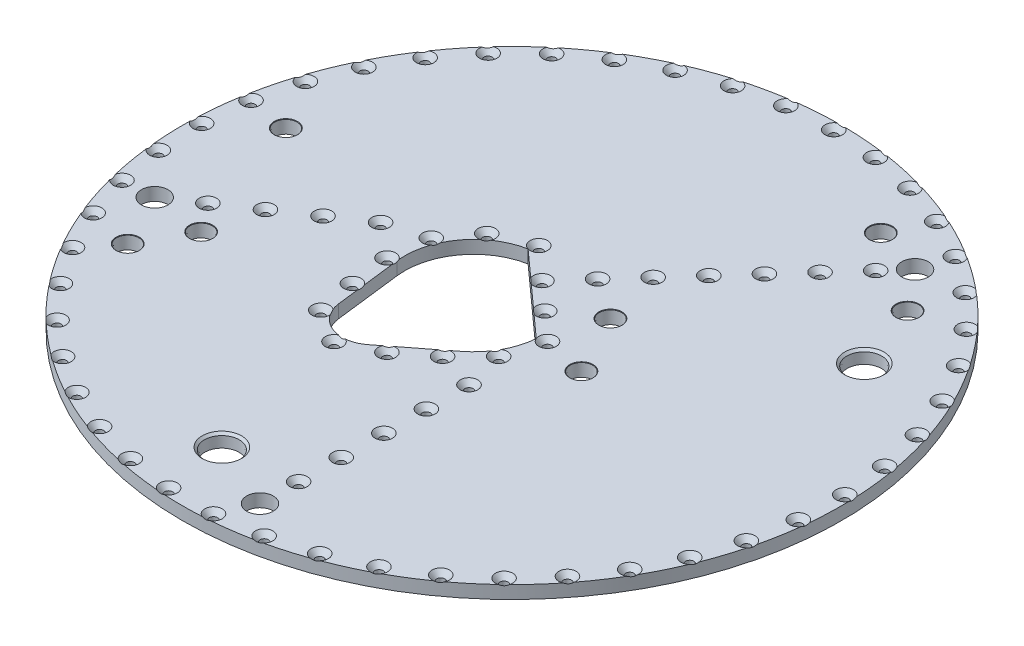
SolidWorks part; units mm, degrees
ref_plane "Front Plane" through (0, 0, 0) normal (0, 0, 1) x (1, 0, 0)
ref_plane "Top Plane" through (0, 0, 0) normal (0, 1, 0) x (1, 0, 0)
ref_plane "Right Plane" through (0, 0, 0) normal (1, 0, 0) x (0, 0, -1)
sketch "Sketch1" plane through (0, 0, 0) normal (0, 1, 0) x (1, 0, 0)
  line L0 (-28.7423, -59.6007) -> (3.5651, -34.4529)
  line L1 (-64.2578, -6.2017) -> (-59.3566, -46.8485)
  line L2 (19.685, -4.826) -> (-30.4091, 40.2789)
  line L3 (0, 0) -> (-76.2073, 0) construction
  line L4 (-172.2388, -46.7164) -> (22.5792, -177.0184) construction
  line L5 (-74.824, -111.8713) -> (98.9891, 148.0013) construction
  circle A0 centre (0, 0) radius 201.93
  arc A1 (3.5651, -34.4529) -> (19.685, -4.826) centre (-22.3579, -1.1494) ccw
  arc A2 (-59.3566, -46.8485) -> (-28.7423, -59.6007) centre (-40.4436, -44.568) ccw
  arc A3 (-30.4091, 40.2789) -> (-64.2578, -6.2017) centre (-22.3579, -1.1494) ccw
  circle A4 centre (98.9891, 148.0013) radius 8.128
  circle A5 centre (-172.2388, -46.7164) radius 8.128
  circle A6 centre (22.5792, -177.0184) radius 8.128
  point P12 (22.5792, -177.0184)
  point P13 (-172.2388, -46.7164)
  dimension "D1" = 403.86
  dimension "D2" = 42.2034
  dimension "D3" = 19.05
  dimension "D4" = 42.2034
  dimension "D20" = 16.256
  dimension "D21" = 16.256
  dimension "D22" = 16.256
  dimension "D15" = 148.0013
  dimension "D5" = 67.4082
  dimension "D6" = 40.6468
  dimension "D7" = 40.9412
  dimension "D8" = 42
  dimension "D9" = 41.124
  dimension "D10" = 79.897
  dimension "D11" = 46.4806
  dimension "D12" = 12.7522
  dimension "D13" = 4.826
  dimension "D14" = 19.685
  dimension "D16" = 312.6416
  dimension "D17" = 234.3772
  dimension "D18" = 117.1956
  dimension "D19" = 178.054
extrude "Extrude1" add sketch "Sketch1" along normal blind 7.9375
hole_wizard "CSK for #10 Flat Head Machine Screw1" positions "3DSketch2" profile "Sketch6" countersink size "#10" standard "Ansi Inch"
sketch3d "3DSketch2"
  point P0 (0, 7.9375, -197.1675)
sketch "Sketch6" plane through (0, 7.9375, -197.1675) normal (1, 0, 0) x (0, 0, 1)
  line L0 (0, 0) -> (0, 7.9375)
  line L1 (0, 7.9375) -> (2.4892, 7.9375)
  line L2 (2.4892, 7.9375) -> (2.4892, 3.2692)
  line L3 (2.4892, 3.2692) -> (5.3311, 0)
  line L5 (5.3311, 0) -> (0, 0)
  line L6 (-2.4892, 3.2692) -> (-5.3311, 0) construction
  line L11 (0, -6.35) -> (0, 107.95) construction
  dimension "Thru Hole Dia." = 4.9784
  dimension "Thru Hole Depth" = 7.9375
  dimension "Near C'Sink Dia." = 10.6622
  dimension "Near C'Sink Angle" = 82
pattern_circular "CirPattern1" count 45 over 360 about axis through (0, 0, 0) along (0, 1, 0) of "CSK for #10 Flat Head Machine Screw1"
sketch "Sketch7" plane through (0, 7.9375, 0) normal (0, 1, 0) x (1, 0, 0)
  line L0 (22.5792, -177.0184) -> (23.8965, -9.293) construction
  line L1 (0, 0) -> (0, -222.0536) construction
  line L3 (98.9891, 148.0013) -> (-9.3265, 27.7046) construction
  line L4 (-172.2388, -46.7164) -> (-54.914, 32.7012) construction
  line L6 (-25.817, -63.3589) -> (6.4905, -38.2111)
  line L7 (-68.9861, -6.7719) -> (-64.0849, -47.4187)
  line L8 (24.5781, -2.8232) -> (-28.9287, 45.3546)
  line L9 (-25.817, -63.3589) -> (6.4905, -38.2111) construction
  line L10 (-68.9861, -6.7719) -> (-64.0849, -47.4187) construction
  line L11 (24.5781, -2.8232) -> (-28.9287, 45.3546) construction
  arc A2 (-31.3176, 44.9539) -> (-68.9861, -6.7719) centre (-22.3579, -1.1494) ccw
  arc A3 (-31.3176, 44.9539) -> (-68.9861, -6.7719) centre (-22.3579, -1.1494) ccw construction
  arc A6 (6.4905, -38.2111) -> (24.5781, -2.8232) centre (-22.3579, -1.1494) ccw
  arc A7 (-64.0849, -47.4187) -> (-25.817, -63.3589) centre (-40.4436, -44.568) ccw
  arc A8 (-28.9287, 45.3546) -> (-68.9861, -6.7719) centre (-22.3579, -1.1494) ccw
  arc A9 (6.4905, -38.2111) -> (24.5781, -2.8232) centre (-22.3579, -1.1494) ccw construction
  arc A10 (-64.0849, -47.4187) -> (-25.817, -63.3589) centre (-40.4436, -44.568) ccw construction
  dimension "D3" = 0.45
  dimension "D1" = 4.7625
  dimension "D2" = 4.7625
hole_wizard "CSK for #10 Flat Head Machine Screw2" positions "3DSketch3" profile "Sketch8" countersink size "#10" standard "Ansi Inch"
sketch3d "3DSketch3"
  point P0 (-9.3265, 7.9375, -27.7046)
sketch "Sketch8" plane through (-9.3265, 7.9375, -27.7046) normal (1, 0, 0) x (0, 0, 1)
  line L0 (0, 0) -> (0, 7.9375)
  line L1 (0, 7.9375) -> (2.4892, 7.9375)
  line L2 (2.4892, 7.9375) -> (2.4892, 3.2692)
  line L3 (2.4892, 3.2692) -> (5.3311, 0)
  line L5 (5.3311, 0) -> (0, 0)
  line L6 (-2.4892, 3.2692) -> (-5.3311, 0) construction
  line L11 (0, -6.35) -> (0, 107.95) construction
  dimension "Thru Hole Dia." = 4.9784
  dimension "Thru Hole Depth" = 7.9375
  dimension "Near C'Sink Dia." = 10.6622
  dimension "Near C'Sink Angle" = 82
pattern_linear "LPattern1" count 7 spacing 24.13 along (0.6691, 0, -0.7431) of "CSK for #10 Flat Head Machine Screw2"
pattern_linear "LPattern2" count 3 spacing 22.8092 along (0.7431, 0, 0.6691) of "CSK for #10 Flat Head Machine Screw2"
hole_wizard "CSK for #10 Flat Head Machine Screw3" positions "3DSketch4" profile "Sketch9" countersink size "#10" standard "Ansi Inch"
sketch3d "3DSketch4"
  point P0 (-28.9287, 7.9375, -45.3546)
sketch "Sketch9" plane through (-28.9287, 7.9375, -45.3546) normal (1, 0, 0) x (0, 0, 1)
  line L0 (0, 0) -> (0, 7.9375)
  line L1 (0, 7.9375) -> (2.4892, 7.9375)
  line L2 (2.4892, 7.9375) -> (2.4892, 3.2692)
  line L3 (2.4892, 3.2692) -> (5.3311, 0)
  line L5 (5.3311, 0) -> (0, 0)
  line L6 (-2.4892, 3.2692) -> (-5.3311, 0) construction
  line L11 (0, -6.35) -> (0, 107.95) construction
  dimension "Thru Hole Dia." = 4.9784
  dimension "Thru Hole Depth" = 7.9375
  dimension "Near C'Sink Dia." = 10.6622
  dimension "Near C'Sink Angle" = 82
pattern_circular "CirPattern2" count 4 over 90 about axis through (-22.3579, 0, 1.1494) along (0, 1, 0) of "CSK for #10 Flat Head Machine Screw3"
hole_wizard "CSK for #10 Flat Head Machine Screw4" positions "3DSketch5" profile "Sketch10" countersink size "#10" standard "Ansi Inch"
sketch3d "3DSketch5"
  line L0 (-68.9861, 7.9375, 6.7719) -> (-64.0849, 7.9375, 47.4187) construction
  line L1 (-25.817, 7.9375, 63.3589) -> (6.4905, 7.9375, 38.2111) construction
  arc A0 (-64.0849, 7.9375, 47.4187) -> (-25.817, 7.9375, 63.3589) centre (-40.4436, 7.9375, 44.568) ccw construction
  arc A1 (-64.4034, 7.9375, 4.7976) -> (-63.8543, 7.9375, 9.5488) centre (-68.8619, 7.9375, 7.7202) ccw construction
  arc A2 (6.4905, 7.9375, 38.2111) -> (24.5781, 7.9375, 2.8232) centre (-22.3579, 7.9375, 1.1494) ccw construction
  point P0 (-65.9616, 7.9375, 31.8543)
  point P4 (-61.4707, 7.9375, 55.7437)
  point P6 (-40.705, 7.9375, 68.3791)
  point P11 (-40.4436, 31.75, 44.568)
  point P12 (-18.7806, 7.9375, 57.8818)
  point P14 (0.4011, 7.9375, 42.951)
  point P18 (17.6218, 7.9375, 25.7953)
  point P23 (-68.8619, 13.2686, 7.7202)
  point P31 (-22.3579, 54.9034, 1.1494)
  dimension "D1" = 24.3078
  dimension "D2" = 24.3078
  dimension "D3" = 24.3078
  dimension "D4" = 24.3078
  dimension "D5" = 24.3078
  dimension "D6" = 24.3078
sketch "Sketch10" plane through (-65.9616, 7.9375, 31.8543) normal (1, 0, 0) x (0, 0, 1)
  line L0 (0, 0) -> (0, 7.9375)
  line L1 (0, 7.9375) -> (2.4892, 7.9375)
  line L2 (2.4892, 7.9375) -> (2.4892, 3.2692)
  line L3 (2.4892, 3.2692) -> (5.3311, 0)
  line L5 (5.3311, 0) -> (0, 0)
  line L6 (-2.4892, 3.2692) -> (-5.3311, 0) construction
  line L11 (0, -6.35) -> (0, 107.95) construction
  dimension "Thru Hole Dia." = 4.9784
  dimension "Thru Hole Depth" = 7.9375
  dimension "Near C'Sink Dia." = 10.6622
  dimension "Near C'Sink Angle" = 82
hole_wizard "CSK for #10 Flat Head Machine Screw5" positions "3DSketch6" profile "Sketch11" countersink size "#10" standard "Ansi Inch"
sketch3d "3DSketch6"
  line L1 (22.5792, 7.9375, 177.0184) -> (23.8965, 7.9375, 9.293) construction
  circle A0 centre (22.5792, 7.9375, 177.0184) radius 8.128 construction
  point P0 (22.7635, 7.9375, 153.5495)
  point P4 (22.967, 7.9375, 127.6423)
  point P6 (23.1705, 7.9375, 101.7351)
  point P8 (23.374, 7.9375, 75.8279)
  point P10 (23.5774, 7.9375, 49.9207)
  point P15 (22.5792, 16.0655, 177.0184)
  dimension "D1" = 25.908
  dimension "D2" = 25.908
  dimension "D3" = 25.908
  dimension "D4" = 25.908
  dimension "D5" = 23.4696
sketch "Sketch11" plane through (22.7635, 7.9375, 153.5495) normal (1, 0, 0) x (0, 0, 1)
  line L0 (0, 0) -> (0, 7.9375)
  line L1 (0, 7.9375) -> (2.4892, 7.9375)
  line L2 (2.4892, 7.9375) -> (2.4892, 3.2692)
  line L3 (2.4892, 3.2692) -> (5.3311, 0)
  line L5 (5.3311, 0) -> (0, 0)
  line L6 (-2.4892, 3.2692) -> (-5.3311, 0) construction
  line L11 (0, -6.35) -> (0, 107.95) construction
  dimension "Thru Hole Dia." = 4.9784
  dimension "Thru Hole Depth" = 7.9375
  dimension "Near C'Sink Dia." = 10.6622
  dimension "Near C'Sink Angle" = 82
hole_wizard "CSK for #10 Flat Head Machine Screw6" positions "3DSketch7" profile "Sketch12" countersink size "#10" standard "Ansi Inch"
sketch3d "3DSketch7"
  line L0 (-172.2388, 7.9375, 46.7164) -> (-54.914, 7.9375, -32.7012) construction
  circle A0 centre (-172.2388, 7.9375, 46.7164) radius 8.128 construction
  point P0 (-152.8032, 7.9375, 33.5604)
  point P4 (-131.7691, 7.9375, 19.3223)
  point P6 (-110.7349, 7.9375, 5.0842)
  point P8 (-89.7007, 7.9375, -9.154)
  point P13 (-172.2388, 16.0655, 46.7164)
  dimension "D4" = 23.4696
  dimension "D1" = 25.4
  dimension "D2" = 25.4
  dimension "D3" = 25.4
sketch "Sketch12" plane through (-152.8032, 7.9375, 33.5604) normal (1, 0, 0) x (0, 0, 1)
  line L0 (0, 0) -> (0, 7.9375)
  line L1 (0, 7.9375) -> (2.4892, 7.9375)
  line L2 (2.4892, 7.9375) -> (2.4892, 3.2692)
  line L3 (2.4892, 3.2692) -> (5.3311, 0)
  line L5 (5.3311, 0) -> (0, 0)
  line L6 (-2.4892, 3.2692) -> (-5.3311, 0) construction
  line L11 (0, -6.35) -> (0, 107.95) construction
  dimension "Thru Hole Dia." = 4.9784
  dimension "Thru Hole Depth" = 7.9375
  dimension "Near C'Sink Dia." = 10.6622
  dimension "Near C'Sink Angle" = 82
hole_wizard "1/2 NPT Tapped Hole1" positions "3DSketch9" profile "Sketch14" size "1/2" standard "Ansi Inch"
sketch3d "3DSketch9"
  point P0 (133.35, 7.9375, -82.55)
  point P2 (-19.05, 7.9375, 158.75)
sketch "Sketch14" plane through (133.35, 7.9375, -82.55) normal (1, 0, 0) x (0, 0, 1)
  line L0 (0, 0) -> (0, 27.9959)
  line L1 (8.9281, 22.6314) -> (0, 27.9959)
  line L2 (-8.9281, 22.6314) -> (0, 27.9959) construction
  line L3 (8.9281, 22.6314) -> (8.9281, 13.5636)
  line L4 (8.9281, 13.5636) -> (10.3035, 13.5636)
  line L5 (10.3035, 13.5636) -> (10.6678, 1.3972)
  line L6 (10.6678, 1.3972) -> (12.065, 0)
  line L7 (12.065, 0) -> (0, 0)
  line L8 (0, -6.35) -> (0, 107.95) construction
  line L9 (-10.6678, 1.3972) -> (-12.065, 0) construction
  line L11 (-8.9281, 13.5636) -> (-10.3035, 13.5636) construction
  line L12 (-10.3035, 13.5636) -> (-10.6678, 1.3972) construction
  dimension "Tap Drill Dia." = 17.8562
  dimension "Tap Drill Depth" = 22.6314
  dimension "Thread Dia." = 21.3355
  dimension "Thread Angle" = 3.43
  dimension "Thread Depth" = 13.5636
  dimension "C'Sink Dia." = 24.13
  dimension "C'Sink Angle" = 90
  dimension "Drill Angle" = 118
hole_wizard "1/4 NPT Tapped Hole2" positions "3DSketch10" profile "Sketch15" size "1/4" standard "Ansi Inch"
sketch3d "3DSketch10"
  arc A0 (-201.8771, 7.9375, -4.6239) -> (-201.0627, 7.9375, 18.6948) centre (0, 7.9375, 0) ccw construction
  point P0 (-168.7677, 7.9375, -30.2088)
  point P4 (0, 209.8675, 0)
  dimension "D1" = 171.45
sketch "Sketch15" plane through (-168.7677, 7.9375, -30.2088) normal (1, 0, 0) x (0, 0, 1)
  line L0 (0, 0) -> (0, 20.4365)
  line L1 (5.5626, 17.0942) -> (0, 20.4365)
  line L2 (-5.5626, 17.0942) -> (0, 20.4365) construction
  line L3 (5.5626, 17.0942) -> (5.5626, 10.033)
  line L4 (5.5626, 10.033) -> (6.5656, 10.033)
  line L5 (6.5656, 10.033) -> (6.8584, 0.2536)
  line L6 (6.8584, 0.2536) -> (7.112, 0)
  line L7 (7.112, 0) -> (0, 0)
  line L8 (0, -6.35) -> (0, 107.95) construction
  line L9 (-6.8584, 0.2536) -> (-7.112, 0) construction
  line L11 (-5.5626, 10.033) -> (-6.5656, 10.033) construction
  line L12 (-6.5656, 10.033) -> (-6.8584, 0.2536) construction
  dimension "Tap Drill Dia." = 11.1252
  dimension "Tap Drill Depth" = 17.0942
  dimension "Thread Dia." = 13.7168
  dimension "Thread Angle" = 3.43
  dimension "Thread Depth" = 10.033
  dimension "C'Sink Dia." = 14.224
  dimension "C'Sink Angle" = 90
  dimension "Drill Angle" = 118
hole_wizard "1/4 NPT Tapped Hole3" positions "3DSketch11" profile "Sketch16" size "1/4" standard "Ansi Inch"
sketch3d "3DSketch11"
  arc A0 (79.9116, 7.9375, -185.445) -> (57.9859, 7.9375, -193.4253) centre (0, 7.9375, 0) ccw construction
  circle A1 centre (98.9891, 7.9375, -148.0013) radius 8.128 construction
  point P0 (69.144, 7.9375, -156.8892)
  point P6 (0, 209.8675, 0)
  point P11 (98.9891, 16.0655, -148.0013)
  dimension "D1" = 171.45
  dimension "D2" = 31.1404
sketch "Sketch16" plane through (69.144, 7.9375, -156.8892) normal (1, 0, 0) x (0, 0, 1)
  line L0 (0, 0) -> (0, 20.4365)
  line L1 (5.5626, 17.0942) -> (0, 20.4365)
  line L2 (-5.5626, 17.0942) -> (0, 20.4365) construction
  line L3 (5.5626, 17.0942) -> (5.5626, 10.033)
  line L4 (5.5626, 10.033) -> (6.5656, 10.033)
  line L5 (6.5656, 10.033) -> (6.8584, 0.2536)
  line L6 (6.8584, 0.2536) -> (7.112, 0)
  line L7 (7.112, 0) -> (0, 0)
  line L8 (0, -6.35) -> (0, 107.95) construction
  line L9 (-6.8584, 0.2536) -> (-7.112, 0) construction
  line L11 (-5.5626, 10.033) -> (-6.5656, 10.033) construction
  line L12 (-6.5656, 10.033) -> (-6.8584, 0.2536) construction
  dimension "Tap Drill Dia." = 11.1252
  dimension "Tap Drill Depth" = 17.0942
  dimension "Thread Dia." = 13.7168
  dimension "Thread Angle" = 3.43
  dimension "Thread Depth" = 10.033
  dimension "C'Sink Dia." = 14.224
  dimension "C'Sink Angle" = 90
  dimension "Drill Angle" = 118
pattern_circular "CirPattern4" count 2 over 20 about axis through (0, 7.9375, 0) along (0, -1, 0) of "1/4 NPT Tapped Hole3"
hole_wizard "1/4 NPT Tapped Hole4" positions "3DSketch12" profile "Sketch21" size "1/4" standard "Ansi Inch"
sketch3d "3DSketch12"
  point P0 (31.75, 7.9375, -28.575)
  point P2 (50.8, 7.9375, 8.255)
  point P4 (-139.7, 7.9375, 50.8)
  point P6 (-155.8168, 7.9375, 79.6735)
sketch "Sketch21" plane through (31.75, 7.9375, -28.575) normal (1, 0, 0) x (0, 0, 1)
  line L0 (0, 0) -> (0, 20.4365)
  line L1 (5.5626, 17.0942) -> (0, 20.4365)
  line L2 (-5.5626, 17.0942) -> (0, 20.4365) construction
  line L3 (5.5626, 17.0942) -> (5.5626, 10.033)
  line L4 (5.5626, 10.033) -> (6.5656, 10.033)
  line L5 (6.5656, 10.033) -> (6.8584, 0.2536)
  line L6 (6.8584, 0.2536) -> (7.112, 0)
  line L7 (7.112, 0) -> (0, 0)
  line L8 (0, -6.35) -> (0, 107.95) construction
  line L9 (-6.8584, 0.2536) -> (-7.112, 0) construction
  line L11 (-5.5626, 10.033) -> (-6.5656, 10.033) construction
  line L12 (-6.5656, 10.033) -> (-6.8584, 0.2536) construction
  dimension "Tap Drill Dia." = 11.1252
  dimension "Tap Drill Depth" = 17.0942
  dimension "Thread Dia." = 13.7168
  dimension "Thread Angle" = 3.43
  dimension "Thread Depth" = 10.033
  dimension "C'Sink Dia." = 14.224
  dimension "C'Sink Angle" = 90
  dimension "Drill Angle" = 118
